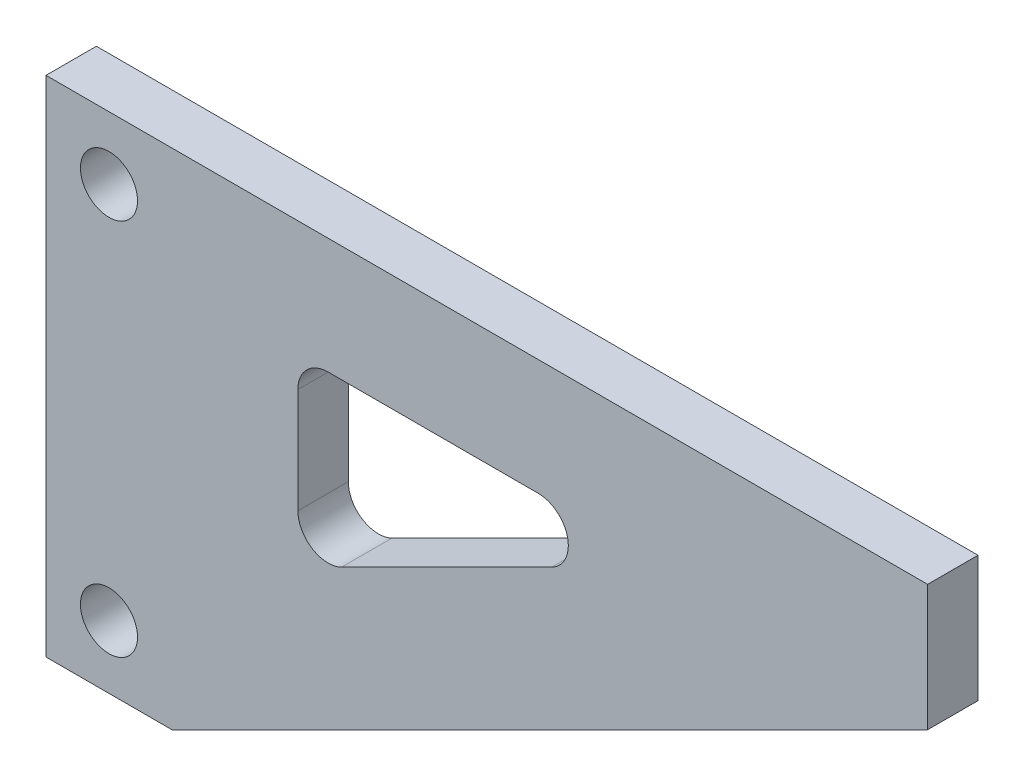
SolidWorks part; units mm, degrees
ref_plane "Front Plane" through (0, 0, 0) normal (0, 0, 1) x (1, 0, 0)
ref_plane "Top Plane" through (0, 0, 0) normal (0, 1, 0) x (1, 0, 0)
ref_plane "Right Plane" through (0, 0, 0) normal (1, 0, 0) x (0, 0, -1)
sketch "Sketch1" plane through (0, 0, 0) normal (0, 0, 1) x (1, 0, 0)
  line L0 (0, 100) -> (175, 100)
  line L1 (175, 100) -> (175, 75)
  line L2 (175, 75) -> (25, 0)
  line L3 (25, 0) -> (0, 0)
  line L4 (0, 0) -> (0, 100)
  dimension "D1" = 100
  dimension "D2" = 175
  dimension "D3" = 25
  dimension "D4" = 25
extrude "Boss-Extrude1" add sketch "Sketch1" along normal mid plane 10
sketch "Sketch2" plane through (0, 0, 5) normal (0, 0, 1) x (1, 0, 0)
  line L0 (50, 71) -> (50, 50.1591)
  line L1 (58.6833, 44.7925) -> (100.3652, 65.6334)
  line L2 (56, 77) -> (97.6819, 77)
  line L3 (25, 0) -> (175, 75) construction
  line L4 (175, 100) -> (0, 100) construction
  line L5 (0, 100) -> (0, 0) construction
  arc A0 (97.6819, 77) -> (100.3652, 65.6334) centre (97.6819, 71) cw
  arc A1 (50, 50.1591) -> (58.6833, 44.7925) centre (56, 50.1591) ccw
  arc A2 (56, 77) -> (50, 71) centre (56, 71) ccw
  dimension "D3" = 6
  dimension "D1" = 23
  dimension "D2" = 25
  dimension "D4" = 50
extrude "Cut-Extrude1" cut sketch "Sketch2" against normal through all
sketch "Sketch3" plane through (0, 0, 5) normal (0, 0, 1) x (1, 0, 0)
  line L0 (0, 100) -> (0, 0) construction
  line L1 (0, 0) -> (25, 0) construction
  circle A0 centre (12.5, 87.5) radius 5.6676
  circle A1 centre (12.5, 12.5) radius 5.6676
  dimension "D1" = 12.5
  dimension "D2" = 12.5
  dimension "D3" = 75
extrude "Cut-Extrude2" cut sketch "Sketch3" against normal through all
